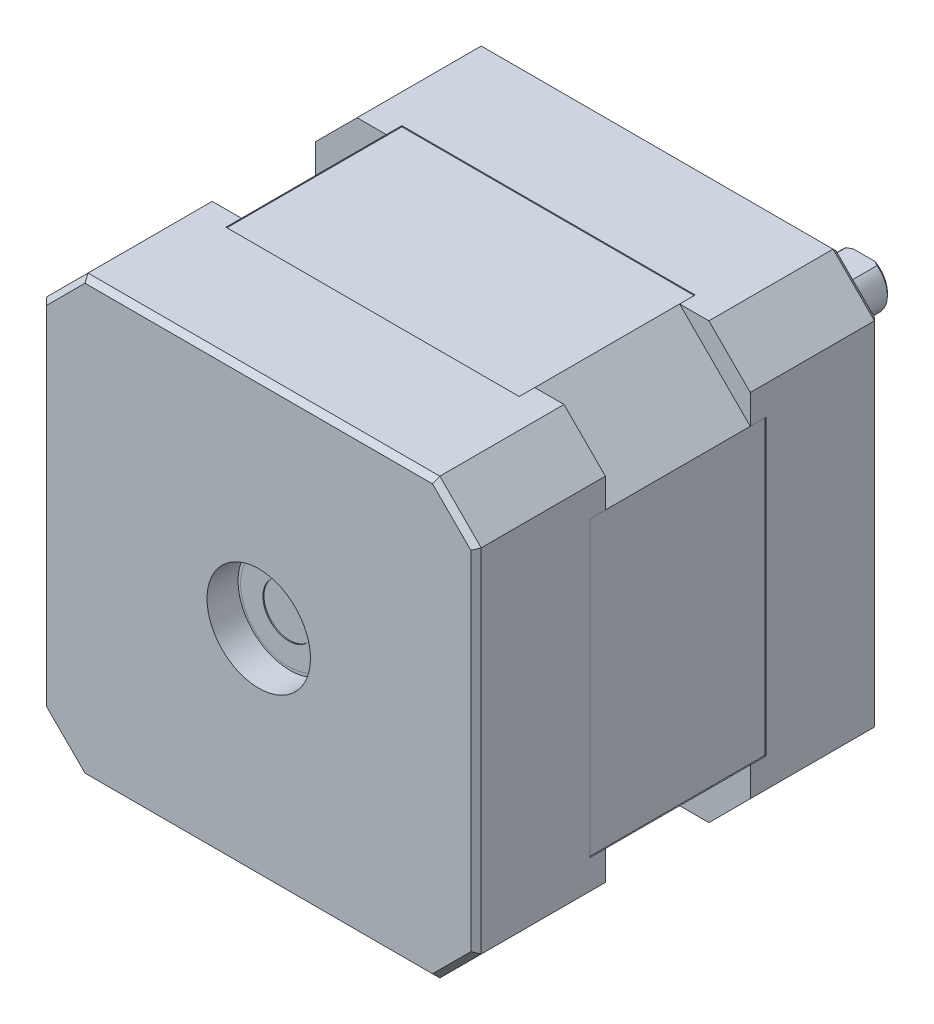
SolidWorks part; units mm, degrees
ref_plane "Alzado" through (0, 0, 0) normal (0, 0, 1) x (1, 0, 0)
ref_plane "Planta" through (0, 0, 0) normal (0, 1, 0) x (1, 0, 0)
ref_plane "Vista lateral" through (0, 0, 0) normal (1, 0, 0) x (0, 0, -1)
sketch "Croquis1" plane through (0, 0, 0) normal (0, 0, 1) x (1, 0, 0)
  line L1 (-21, 21) -> (21, 21)
  line L2 (-21, 21) -> (-21, -21)
  line L3 (-21, -21) -> (21, -21)
  line L4 (21, 21) -> (21, -21)
  line L5 (-21, 21) -> (21, -21) construction
  line L6 (-21, -21) -> (21, 21) construction
  point P0 (0, 0)
extrude "Saliente-Extruir1" add sketch "Croquis1" along normal blind 39
chamfer "Chaflán2" distance 4 angle 45 4 edges at (21, -21, 19.5) (21, 21, 19.5) (-21, 21, 19.5) (-21, -21, 19.5)
chamfer "Chaflán3" distance 0.5 angle 45 16 edges at (-19, -19, 39) (-21, 0, 39) (-19, 19, 39) (0, 21, 39) (19, 19, 39) (21, 0, 39) (19, -19, 39) (0, -21, 39) (19, 19, 0) (0, 21, 0) (-19, 19, 0) (-21, 0, 0) (-19, -19, 0) (0, -21, 0) (19, -19, 0) (21, 0, 0)
sketch "Croquis2" plane through (0, 0, 0) normal (0, 0, -1) x (-1, 0, 0)
  circle A0 centre (0, 0) radius 15
extrude "Cortar-Extruir2" cut sketch "Croquis2" against normal blind 0.5
chamfer "Chaflán4" distance 1 angle 45 1 edges at (-15, 0, 0.5)
sketch "Croquis3" plane through (0, 0, 0.5) normal (0, 0, -1) x (-1, 0, 0)
  circle A0 centre (0, 0) radius 11
  circle A1 centre (0, 0) radius 4.75
extrude "Saliente-Extruir2" add sketch "Croquis3" along normal blind 2.5
sketch "Croquis4" plane through (0, 0, 0.5) normal (0, 0, -1) x (-1, 0, 0)
  circle A0 centre (0, 0) radius 2.5
extrude "Saliente-Extruir3" add sketch "Croquis4" along normal blind 20
chamfer "Chaflán5" distance 0.25 angle 45 1 edges at (-2.5, 0, -19.5)
sketch "Croquis5" plane through (0, 0, -19.5) normal (0, 0, -1) x (-1, 0, 0)
  line L1 (-18.1031, 12.3221) -> (8.4507, 12.3221)
  line L2 (-18.1031, 12.3221) -> (-18.1031, 2)
  line L3 (-18.1031, 2) -> (8.4507, 2)
  line L4 (8.4507, 12.3221) -> (8.4507, 2)
  line L5 (-18.1031, 12.3221) -> (8.4507, 2) construction
  line L6 (-18.1031, 2) -> (8.4507, 12.3221) construction
  point P0 (-4.8262, 7.161)
  dimension "D1" = 2
extrude "Cortar-Extruir3" cut sketch "Croquis5" against normal up to surface (17.5 mm away)
sketch "Croquis6" plane through (0, 0, 0) normal (0, 0, -1) x (-1, 0, 0)
  line L1 (-21, -17) -> (-21, 17) construction
  line L2 (-17, 21) -> (17, 21) construction
  circle A0 centre (-15.35, 15.35) radius 1.5
  dimension "D1" = 5.65
  dimension "D2" = 5.65
extrude "Cortar-Extruir4" cut sketch "Croquis6" against normal blind 12
pattern_circular "MatrizC1" count 4 over 360 about axis through (0, 0, 0) along (0, 0, 1) of "Cortar-Extruir4"
sketch "Croquis7" plane through (-19, -19, 0) normal (-0.7071, -0.7071, 0) x (0, 0, 1)
  line L0 (0, -2.6213) -> (0, 2.6213) construction
  line L1 (12.5, -8.4668) -> (26.5, -8.4668)
  line L2 (12.5, -8.4668) -> (12.5, 8.4668)
  line L3 (12.5, 8.4668) -> (26.5, 8.4668)
  line L4 (26.5, -8.4668) -> (26.5, 8.4668)
  line L5 (12.5, -8.4668) -> (26.5, 8.4668) construction
  line L6 (12.5, 8.4668) -> (26.5, -8.4668) construction
  point P0 (19.5, 0)
  dimension "D1" = 14
  dimension "D2" = 19.5
extrude "Cortar-Extruir5" cut sketch "Croquis7" against normal blind 2
pattern_circular "MatrizC2" count 4 over 360 about axis through (0, 0, 0) along (0, 0, 1) of "Cortar-Extruir5"
sketch "Croquis8" plane through (0, 21, 0) normal (0, 1, 0) x (1, 0, 0)
  line L0 (-14.1716, -12.5) -> (-14.1716, -26.5)
  line L1 (14.1716, -12.5) -> (14.1716, -26.5)
  line L2 (-14.1716, -12.5) -> (-14.1716, -11)
  line L3 (-14.1716, -11) -> (14.1716, -11)
  line L4 (14.1716, -12.5) -> (14.1716, -11)
  line L6 (-14.1716, -26.5) -> (-14.1716, -28)
  line L7 (-14.1716, -28) -> (14.1716, -28)
  line L8 (14.1716, -26.5) -> (14.1716, -28)
extrude "Cortar-Extruir6" cut sketch "Croquis8" against normal blind 0.1
pattern_circular "MatrizC3" count 4 over 360 about axis through (0, 0, -19.5) along (0, 0, 1) of "Cortar-Extruir6"
sketch "Croquis9" plane through (0, 0, 39) normal (0, 0, 1) x (1, 0, 0)
  circle A0 centre (0, 0) radius 5
extrude "Cortar-Extruir7" cut sketch "Croquis9" against normal blind 3
sketch "Croquis10" plane through (0, 0, 36) normal (0, 0, 1) x (1, 0, 0)
  circle A0 centre (0, 0) radius 4.65
  circle A1 centre (0, 0) radius 2.5
extrude "Saliente-Extruir4" add sketch "Croquis10" along normal blind 0.1
